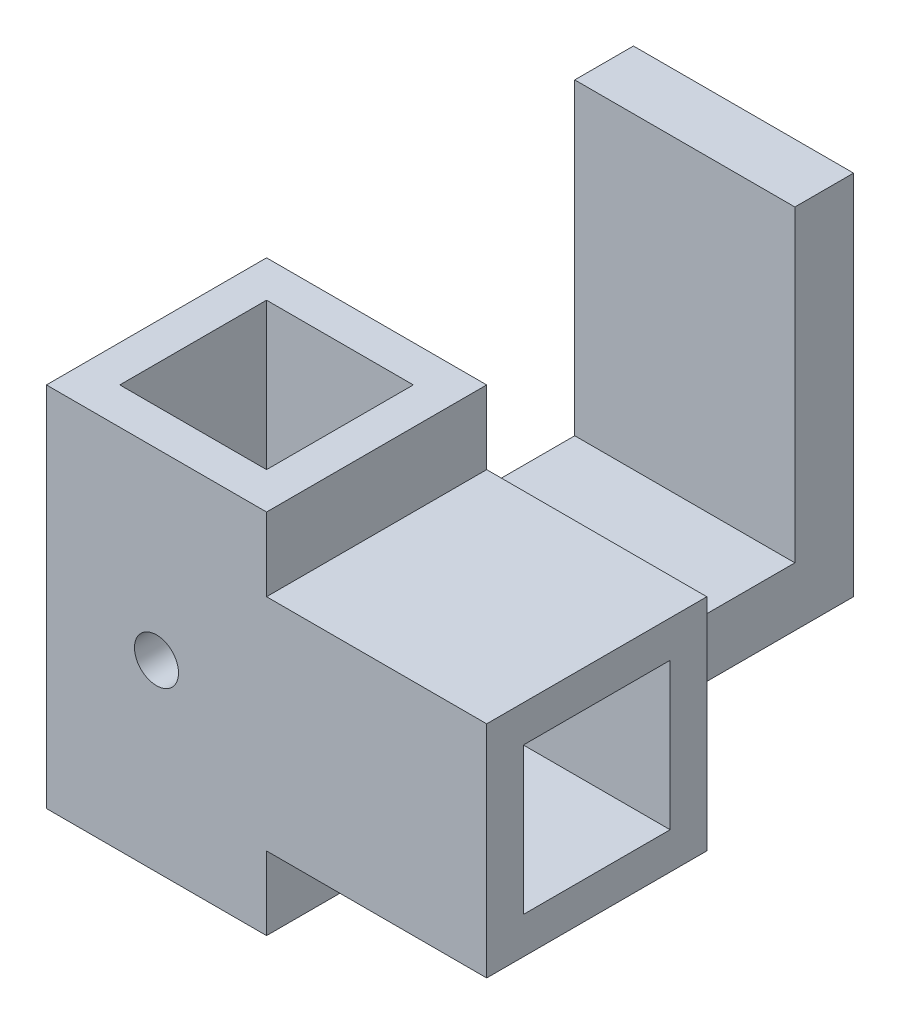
SolidWorks part; units mm, degrees
ref_plane "Alzado" through (0, 0, 0) normal (0, 0, 1) x (1, 0, 0)
ref_plane "Planta" through (0, 0, 0) normal (0, 1, 0) x (1, 0, 0)
ref_plane "Vista lateral" through (0, 0, 0) normal (1, 0, 0) x (0, 0, -1)
sketch "Sketch1" plane through (0, 0, 0) normal (0, 0, 1) x (1, 0, 0)
  line L0 (15, 15) -> (15, 25)
  line L1 (-15, -25) -> (15, -25)
  line L2 (-15, -25) -> (-15, 25)
  line L3 (-15, 25) -> (15, 25)
  line L4 (15, -25) -> (15, -15)
  line L5 (-15, -25) -> (15, 25) construction
  line L6 (-15, 25) -> (15, -25) construction
  line L7 (15, 15) -> (45, 15)
  line L9 (15, -15) -> (45, -15)
  line L10 (45, 15) -> (45, -15)
  circle A0 centre (0, 0) radius 3
  point P0 (0, 0)
  point P10 (45, 0)
  dimension "D5" = 6
  dimension "D1" = 30
  dimension "D2" = 50
  dimension "D3" = 45
  dimension "D4" = 30
extrude "Boss-Extrude1" add sketch "Sketch1" along normal mid plane 30
sketch "Sketch2" plane through (0, 25, 0) normal (0, 1, 0) x (1, 0, 0)
  line L8 (10, 10) -> (-10, 10)
  line L9 (-10, 10) -> (-10, -10)
  line L10 (-10, -10) -> (10, -10)
  line L11 (10, -10) -> (10, 10)
  line L12 (10, 10) -> (-10, 10)
  line L13 (-10, 10) -> (-10, -10)
  line L14 (-10, -10) -> (10, -10)
  line L15 (10, -10) -> (10, 10)
  dimension "D1" = 5
extrude "Cut-Extrude1" cut sketch "Sketch2" against normal blind 59
sketch "Sketch3" plane through (45, 0, 0) normal (1, 0, 0) x (0, 0, -1)
  line L8 (10, -10) -> (10, 10)
  line L9 (10, 10) -> (-10, 10)
  line L10 (-10, 10) -> (-10, -10)
  line L11 (-10, -10) -> (10, -10)
  line L12 (10, -10) -> (10, 10)
  line L13 (10, 10) -> (-10, 10)
  line L14 (-10, 10) -> (-10, -10)
  line L15 (-10, -10) -> (10, -10)
  dimension "D1" = 5
extrude "Cut-Extrude2" cut sketch "Sketch3" against normal blind 25
sketch "Sketch4" plane through (-10, 0, 0) normal (1, 0, 0) x (0, 0, -1)
  line L0 (15, -17) -> (57, -17)
  line L1 (15, 25) -> (57, 25) construction
  line L2 (15, 25) -> (15, -17) construction
  line L3 (15, -17) -> (57, -17) construction
  line L4 (57, 25) -> (57, -17) construction
  line L5 (57, -17) -> (57, 25)
  line L6 (15, -25) -> (65, -25)
  line L7 (65, -25) -> (65, 25)
  line L8 (15, -25) -> (15, -17)
  line L9 (57, 25) -> (65, 25)
  dimension "D1" = 42
  dimension "D2" = 42
  dimension "D3" = 8
extrude "Boss-Extrude2" add sketch "Sketch4" along normal blind 25 and the other way blind 5 contours L9 L7 L6 L8 L0 L5
